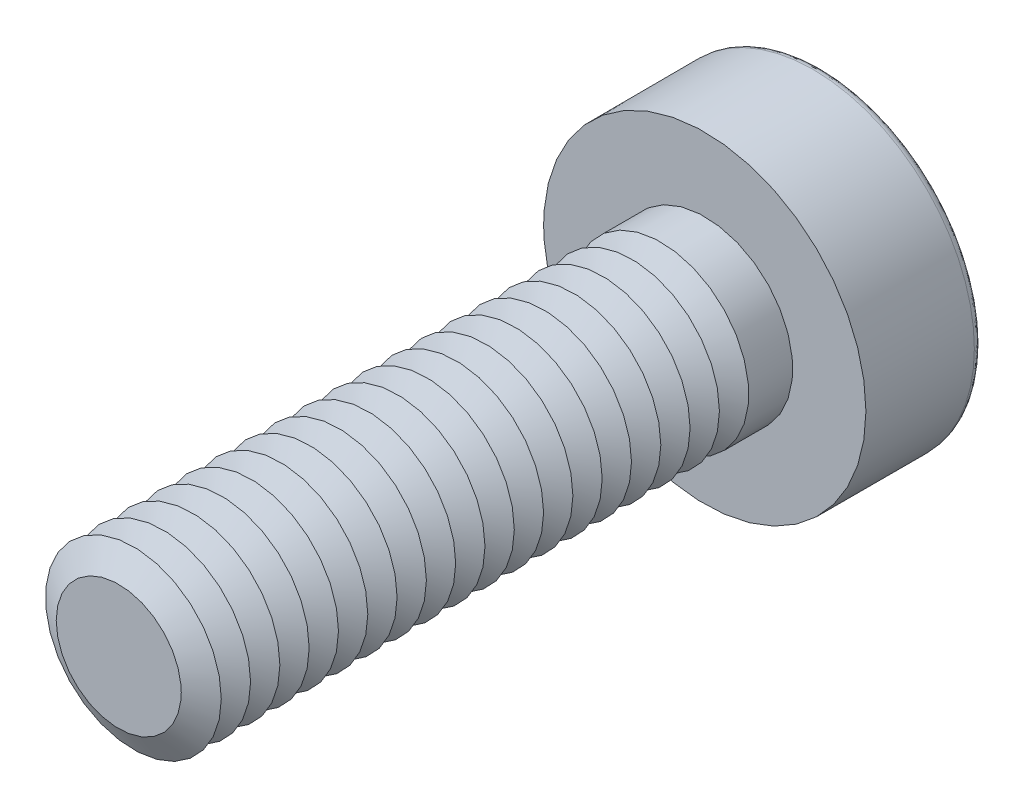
SolidWorks part; units mm, degrees
ref_plane "Front Plane" through (0, 0, 0) normal (0, 0, 1) x (1, 0, 0)
ref_plane "Top Plane" through (0, 0, 0) normal (0, 1, 0) x (1, 0, 0)
ref_plane "Right Plane" through (0, 0, 0) normal (1, 0, 0) x (0, 0, -1)
sketch "Sketch1" plane through (0, 0, 0) normal (0, 0, 1) x (1, 0, 0)
  circle A0 centre (0, 0) radius 1.5
  dimension "D1" = 3
extrude "Boss-Extrude1" add sketch "Sketch1" along normal blind 10
sketch "Sketch2" plane through (0, 0, 0) normal (0, 0, -1) x (-1, 0, 0)
  circle A0 centre (0, 0) radius 2.75
  dimension "D1" = 5.5
extrude "Boss-Extrude2" add sketch "Sketch2" along normal blind 2
sketch "Sketch3" plane through (0, 0, -2) normal (0, 0, -1) x (-1, 0, 0)
  line L1 (-0.5774, 1) -> (-1.1547, 0)
  line L2 (-1.1547, 0) -> (-0.5774, -1)
  line L3 (-0.5774, -1) -> (0.5774, -1)
  line L4 (0.5774, -1) -> (1.1547, 0)
  line L5 (1.1547, 0) -> (0.5774, 1)
  line L6 (0.5774, 1) -> (-0.5774, 1)
  circle A0 centre (0, 0) radius 1 construction
  dimension "D1" = 2
extrude "Cut-Extrude1" cut sketch "Sketch3" against normal blind 1.5
fillet "Fillet1" radius 0.15 1 edges at (-2.75, 0, -2)
sketch "Sketch4" plane through (0, 0, -0.5) normal (0, 0, -1) x (-1, 0, 0)
  line L0 (0.5774, -1) -> (1.1547, 0) construction
  circle A0 centre (0, 0) radius 1
extrude "Cut-Extrude2" cut sketch "Sketch4" against normal through all draft 60
sketch "Sketch5" plane through (0, 0, -2) normal (0, 0, -1) x (-1, 0, 0)
  circle A0 centre (0, 0) radius 1.1547
extrude "Cut-Extrude3" cut sketch "Sketch5" against normal through all draft 75
sketch "Sketch7" plane through (0, 0, 0) normal (1, 0, 0) x (0, 0, -1)
  line L25 (-10, 1.067) -> (-9.75, 1.5)
  line L26 (-10, 1.5) -> (-10, -1.5) construction
  line L27 (-9.75, 1.5) -> (-10.25, 1.5)
  line L28 (-10.25, 1.5) -> (-10, 1.067)
  line L29 (0, 1.5) -> (-10, 1.5) construction
  dimension "D1" = 0.5
revolve "Cut-Revolve1" cut sketch "Sketch7" angle 360 about axis through (0, 0, 10) along (0, 0, -1)
pattern_linear "LPattern1" count 19 spacing 0.5 along (0, 0, -1) of "Cut-Revolve1"
